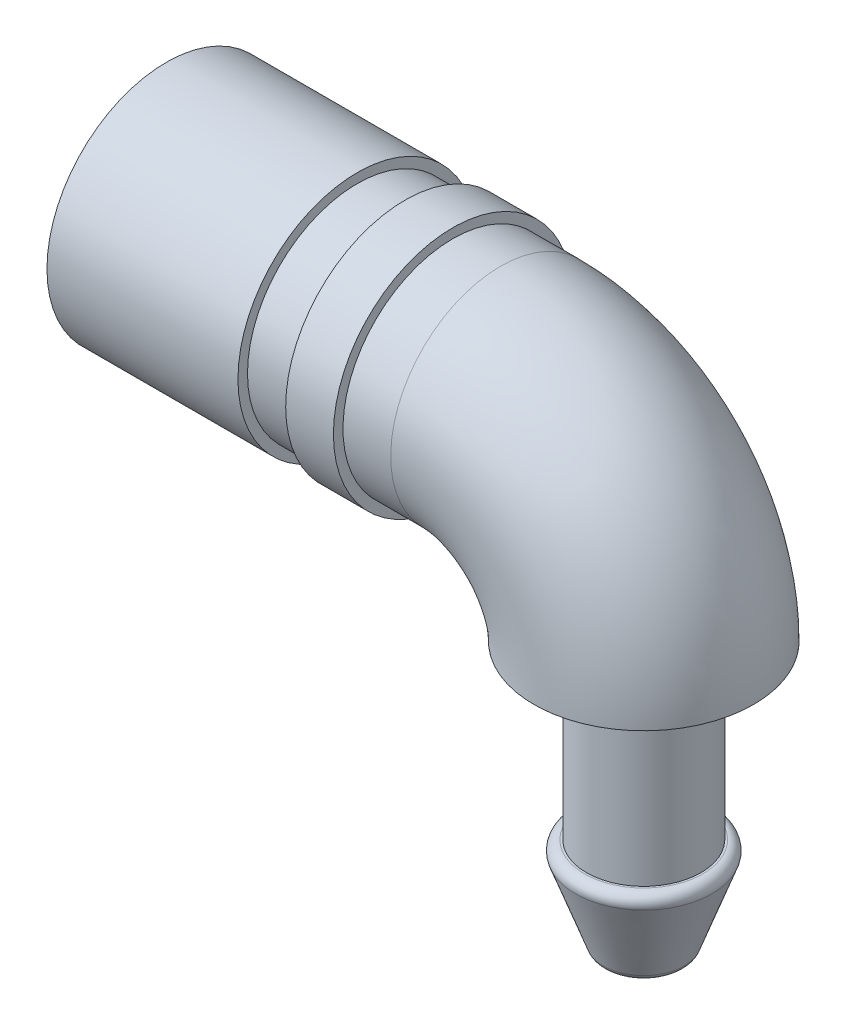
SolidWorks part; units mm, degrees
ref_plane "Alzado" through (0, 0, 0) normal (0, 0, 1) x (1, 0, 0)
ref_plane "Planta" through (0, 0, 0) normal (0, 1, 0) x (1, 0, 0)
ref_plane "Vista lateral" through (0, 0, 0) normal (1, 0, 0) x (0, 0, -1)
sketch "Croquis1" plane through (0, 0, 0) normal (0, 0, 1) x (1, 0, 0)
  line L0 (0, 0) -> (28.3235, 0) construction
  line L1 (0, 0) -> (0, 12.5)
  line L2 (0, 12.5) -> (20, 12.5)
  line L3 (20, 12.5) -> (20, 11.5)
  line L4 (20, 11.5) -> (25, 11.5)
  line L5 (25, 11.5) -> (25, 12.5)
  line L6 (25, 12.5) -> (30, 12.5)
  line L7 (30, 12.5) -> (30, 0)
  line L8 (30, 0) -> (0, 0)
  dimension "D1" = 25
  dimension "D2" = 20
  dimension "D3" = 1
  dimension "D4" = 5
revolve "Revolución1" add sketch "Croquis1" angle 360 about L0
ref_plane "Plano1" through (0, 0, 11.5) normal (0, 0, 1) x (1, 0, 0)
sketch "Croquis2" plane through (0, 0, 11.5) normal (0, 0, 1) x (1, 0, 0)
  line L0 (30, 0) -> (35, 0)
  line L1 (30, -12.5) -> (30, 12.5) construction
  line L2 (50, -15) -> (50, -15.0029)
  arc A0 (50, -15) -> (35, 0) centre (35, -15) ccw
  point P8 (50, 0)
  dimension "D2" = 15
  dimension "D1" = 20
sketch "Croquis3" plane through (30, 0, 0) normal (1, 0, 0) x (0, 0, -1)
  circle A0 centre (0, 0) radius 11.5
sweep "Barrer1" add profiles "Croquis3" path "Croquis2"
sketch "Croquis4" plane through (0, 0, 0) normal (0, 0, 1) x (1, 0, 0)
  line L0 (50, -15.0029) -> (50, -43.0029) construction
  line L1 (38.5, -15.0029) -> (61.5, -15.0029) construction
  line L2 (50, -15.0029) -> (56, -15.0029)
  line L3 (56, -15.0029) -> (56, -33.0029)
  line L4 (56, -33.0029) -> (57.6397, -33.0029)
  line L5 (57.6397, -33.0029) -> (54, -43.0029)
  line L6 (54, -43.0029) -> (50, -43.0029)
  line L7 (50, -43.0029) -> (50, -15.0029)
  point P4 (49, -27.5331)
  point P9 (51.048, -30.003)
  point P10 (53.0959, -31.8143)
  point P11 (49, -28.0271)
  dimension "D1" = 28
  dimension "D2" = 12
  dimension "D3" = 18
  dimension "D4" = 4
  dimension "D5" = 110
revolve "Revolución2" add sketch "Croquis4" angle 360 about L0
fillet "Redondeo1" radius 1 2 edges at (50, -43.0029, 4) (50, -33.0029, 7.6397)
